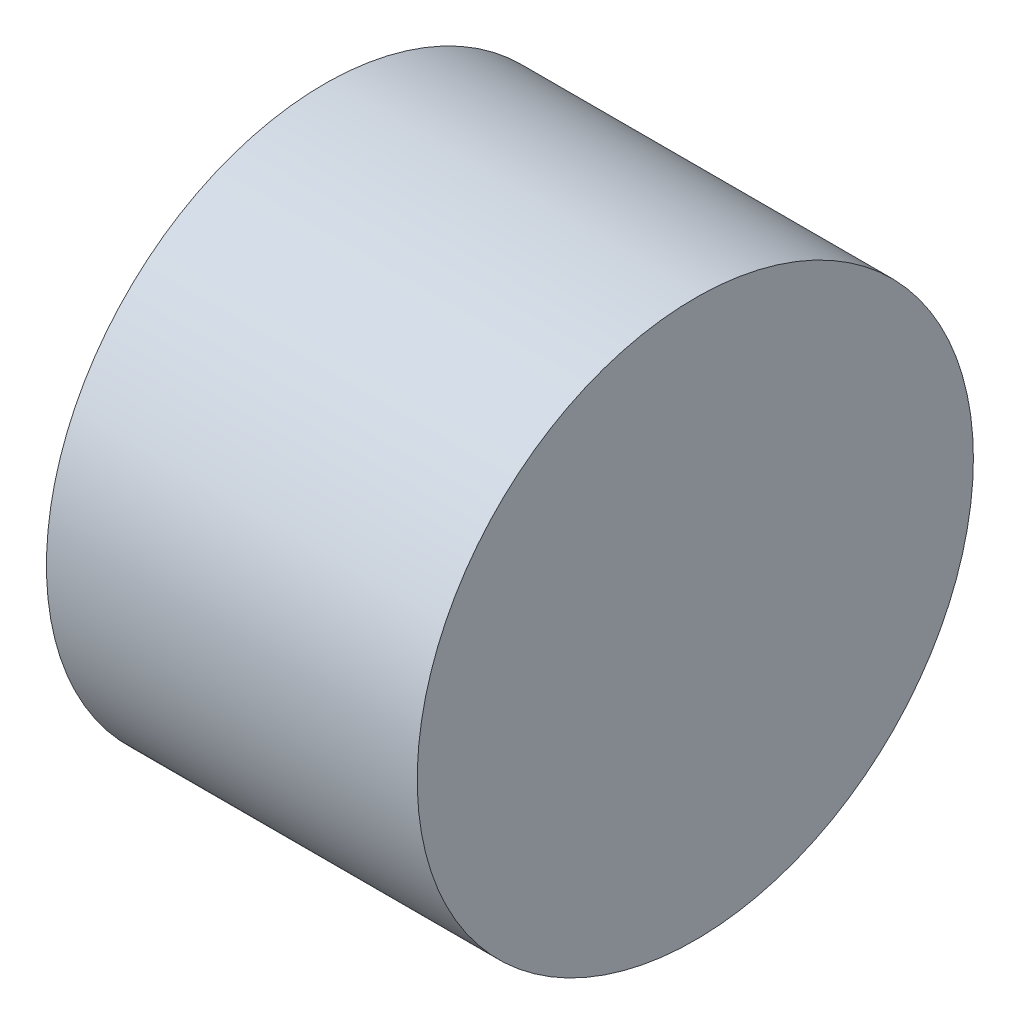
SolidWorks part; units mm, degrees
ref_plane "Plan de face" through (0, 0, 0) normal (0, 0, 1) x (1, 0, 0)
ref_plane "Plan de dessus" through (0, 0, 0) normal (0, 1, 0) x (1, 0, 0)
ref_plane "Plan de droite" through (0, 0, 0) normal (1, 0, 0) x (0, 0, -1)
sketch "Esquisse1" plane through (0, 0, 0) normal (1, 0, 0) x (0, 0, -1)
  circle A0 centre (0, 0) radius 7.5
  dimension "D1" = 15
extrude "Extrusion1" add sketch "Esquisse1" along normal blind 10
